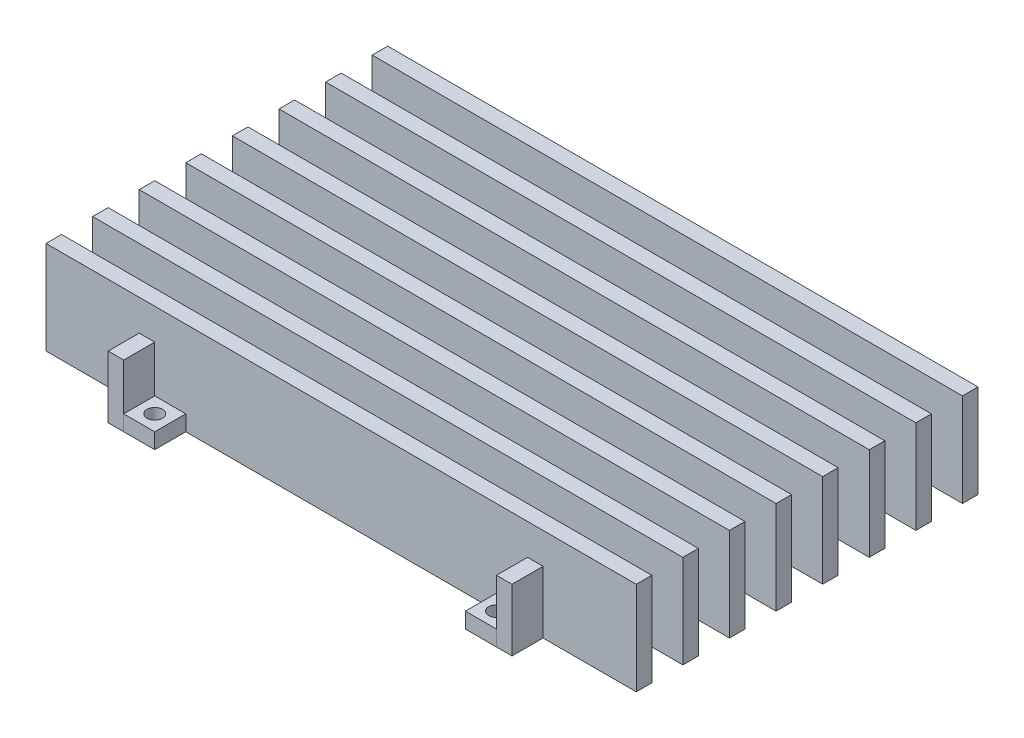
SolidWorks part; units mm, degrees
ref_plane "Front Plane" through (0, 0, 0) normal (0, 0, 1) x (1, 0, 0)
ref_plane "Top Plane" through (0, 0, 0) normal (0, 1, 0) x (1, 0, 0)
ref_plane "Right Plane" through (0, 0, 0) normal (1, 0, 0) x (0, 0, -1)
sketch "Sketch2" plane through (0, 0, 0) normal (0, 1, 0) x (1, 0, 0)
  line L0 (-60.325, -22.225) -> (60.325, -25.4) construction
  line L1 (-60.325, -31.75) -> (60.325, -31.75)
  line L2 (-60.325, -31.75) -> (-60.325, -34.925)
  line L3 (-60.325, -34.925) -> (60.325, -34.925)
  line L4 (60.325, -31.75) -> (60.325, -34.925)
  line L5 (-60.325, -31.75) -> (60.325, -34.925) construction
  line L6 (-60.325, -34.925) -> (60.325, -31.75) construction
  line L7 (-60.325, -25.4) -> (60.325, -22.225) construction
  line L8 (-60.325, -22.225) -> (-60.325, -25.4)
  line L9 (-60.325, -22.225) -> (60.325, -22.225)
  line L10 (60.325, -22.225) -> (60.325, -25.4)
  line L11 (-60.325, -25.4) -> (60.325, -25.4)
  line L12 (-60.325, -12.7) -> (60.325, -15.875) construction
  line L13 (-60.325, -15.875) -> (60.325, -12.7) construction
  line L14 (-60.325, -12.7) -> (-60.325, -15.875)
  line L15 (-60.325, -12.7) -> (60.325, -12.7)
  line L16 (60.325, -12.7) -> (60.325, -15.875)
  line L17 (-60.325, -15.875) -> (60.325, -15.875)
  line L18 (-60.325, -3.175) -> (60.325, -6.35) construction
  line L19 (-60.325, -6.35) -> (60.325, -3.175) construction
  line L20 (-60.325, -3.175) -> (-60.325, -6.35)
  line L21 (-60.325, -3.175) -> (60.325, -3.175)
  line L22 (60.325, -3.175) -> (60.325, -6.35)
  line L23 (-60.325, -6.35) -> (60.325, -6.35)
  line L24 (-60.325, 6.35) -> (60.325, 3.175) construction
  line L25 (-60.325, 3.175) -> (60.325, 6.35) construction
  line L26 (-60.325, 6.35) -> (-60.325, 3.175)
  line L27 (-60.325, 6.35) -> (60.325, 6.35)
  line L28 (60.325, 6.35) -> (60.325, 3.175)
  line L29 (-60.325, 3.175) -> (60.325, 3.175)
  line L30 (-60.325, 15.875) -> (60.325, 12.7) construction
  line L31 (-60.325, 12.7) -> (60.325, 15.875) construction
  line L32 (-60.325, 15.875) -> (-60.325, 12.7)
  line L33 (-60.325, 15.875) -> (60.325, 15.875)
  line L34 (60.325, 15.875) -> (60.325, 12.7)
  line L35 (-60.325, 12.7) -> (60.325, 12.7)
  line L36 (-60.325, 25.4) -> (60.325, 22.225) construction
  line L37 (-60.325, 22.225) -> (60.325, 25.4) construction
  line L38 (-60.325, 25.4) -> (-60.325, 22.225)
  line L39 (-60.325, 25.4) -> (60.325, 25.4)
  line L40 (60.325, 25.4) -> (60.325, 22.225)
  line L41 (-60.325, 22.225) -> (60.325, 22.225)
  line L42 (-60.325, 34.925) -> (60.325, 31.75) construction
  line L43 (-60.325, 31.75) -> (60.325, 34.925) construction
  line L44 (-60.325, 34.925) -> (-60.325, 31.75)
  line L45 (-60.325, 34.925) -> (60.325, 34.925)
  line L46 (60.325, 34.925) -> (60.325, 31.75)
  line L47 (-60.325, 31.75) -> (60.325, 31.75)
  line L48 (0, -3.175) -> (0, 3.175) construction
  point P0 (0, -33.3375)
  point P5 (0, 0)
  point P35 (0, 0)
  point P36 (0, -1.2314)
  point P39 (0, 0)
  point P40 (0, 0)
  dimension "D2" = 3.175
  dimension "D3" = 6.35
  dimension "D4" = 120.65
  dimension "D1" = 8
extrude "Boss-Extrude1" add sketch "Sketch2" along normal mid plane 19.05
sketch "Sketch3" plane through (0, -9.525, 0) normal (0, -1, 0) x (1, 0, 0)
  line L0 (-38.1, 0) -> (38.1, 0) construction
  line L1 (-38.1, -41.275) -> (-41.275, -41.275)
  line L2 (-38.1, -41.275) -> (-38.1, 41.275)
  line L3 (-38.1, 41.275) -> (-41.275, 41.275)
  line L4 (-41.275, -41.275) -> (-41.275, 41.275)
  line L5 (-38.1, -41.275) -> (-41.275, 41.275) construction
  line L6 (-38.1, 41.275) -> (-41.275, -41.275) construction
  line L7 (41.275, -41.275) -> (38.1, -41.275)
  line L8 (41.275, -41.275) -> (41.275, 41.275)
  line L9 (41.275, 41.275) -> (38.1, 41.275)
  line L10 (38.1, -41.275) -> (38.1, 41.275)
  line L11 (41.275, -41.275) -> (38.1, 41.275) construction
  line L12 (41.275, 41.275) -> (38.1, -41.275) construction
  line L13 (-60.325, -34.925) -> (-60.325, -31.75) construction
  point P0 (-39.6875, 0)
  point P5 (39.6875, 0)
  point P10 (-38.0559, 0)
  point P14 (0, 0)
  dimension "D1" = 76.2
  dimension "D2" = 82.55
extrude "Boss-Extrude2" add sketch "Sketch3" against normal blind 12.7
sketch "Sketch4" plane through (0, -9.525, 0) normal (0, -1, 0) x (1, 0, 0)
  line L0 (41.275, -41.275) -> (41.275, -34.925) construction
  line L1 (38.1, -34.925) -> (31.75, -34.925)
  line L2 (38.1, -34.925) -> (38.1, -41.275)
  line L3 (38.1, -41.275) -> (31.75, -41.275)
  line L4 (31.75, -34.925) -> (31.75, -41.275)
  line L5 (-31.75, -34.925) -> (-31.75, -41.275)
  line L6 (0, 0) -> (-24.1959, 0) construction
  line L7 (0, 0) -> (0, -19.1592) construction
  line L10 (-38.1, -41.275) -> (-31.75, -41.275)
  line L11 (-38.1, -34.925) -> (-38.1, -41.275)
  line L12 (-38.1, -34.925) -> (-31.75, -34.925)
  line L13 (-38.1, 34.925) -> (-31.75, 34.925)
  line L14 (-38.1, 34.925) -> (-38.1, 41.275)
  line L15 (-38.1, 41.275) -> (-31.75, 41.275)
  line L16 (-31.75, 34.925) -> (-31.75, 41.275)
  line L17 (31.75, 34.925) -> (31.75, 41.275)
  line L18 (38.1, 41.275) -> (31.75, 41.275)
  line L19 (38.1, 34.925) -> (38.1, 41.275)
  line L20 (38.1, 34.925) -> (31.75, 34.925)
  circle A0 centre (34.925, -38.1) radius 1.5875
  circle A1 centre (-34.925, -38.1) radius 1.5875
  circle A2 centre (-34.925, 38.1) radius 1.5875
  circle A3 centre (34.925, 38.1) radius 1.5875
  dimension "D3" = 3.175
  dimension "D1" = 3.175
  dimension "D2" = 3.175
extrude "Boss-Extrude3" add sketch "Sketch4" against normal blind 3.175 separate body
